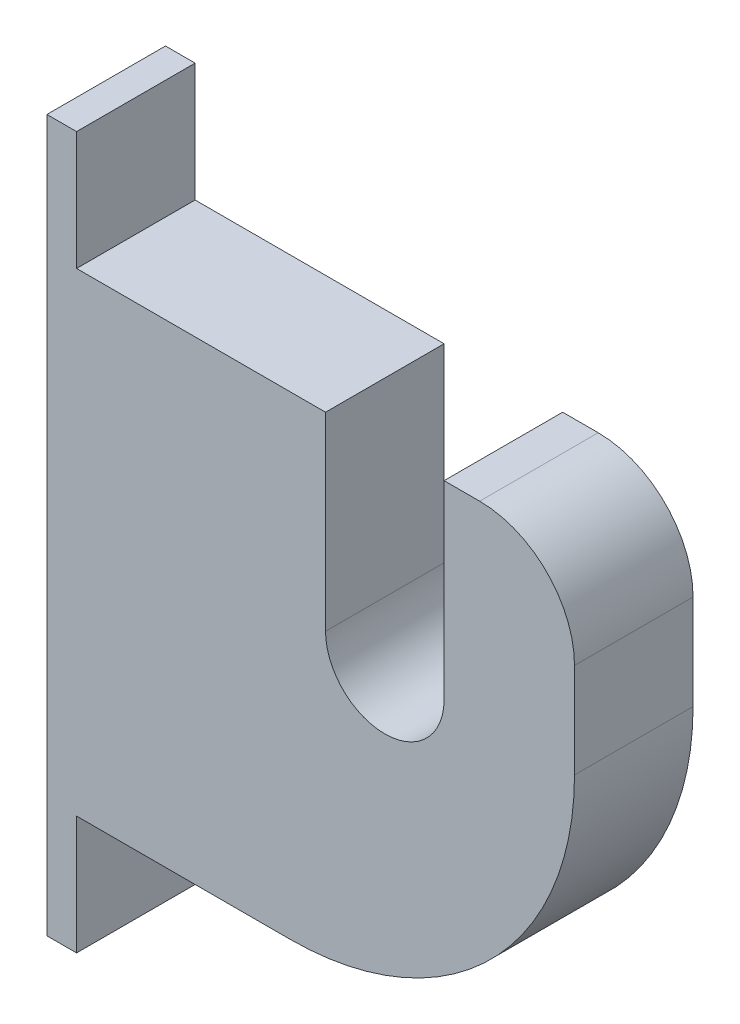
SolidWorks part; units mm, degrees
ref_plane "Front Plane" through (0, 0, 0) normal (0, 0, 1) x (1, 0, 0)
ref_plane "Top Plane" through (0, 0, 0) normal (0, 1, 0) x (1, 0, 0)
ref_plane "Right Plane" through (0, 0, 0) normal (1, 0, 0) x (0, 0, -1)
sketch "Sketch1" plane through (0, 0, 0) normal (0, 0, 1) x (1, 0, 0)
  line L0 (95.25, 1.27) -> (95.25, 3.81)
  line L1 (92.71, 6.35) -> (91.7575, 6.35)
  line L2 (88.5825, 6.35) -> (88.5825, 1.27)
  line L3 (88.5825, 6.35) -> (85.09, 6.35)
  line L4 (91.7575, 6.35) -> (91.7575, 1.27)
  line L5 (81.915, -6.35) -> (87.63, -6.35)
  line L6 (85.09, 6.35) -> (81.915, 6.35)
  line L9 (81.915, 6.35) -> (81.915, 9.525)
  line L10 (81.915, 9.525) -> (81.1213, 9.525)
  line L12 (81.1213, -6.35) -> (81.1213, 6.35)
  line L14 (81.1213, 6.35) -> (81.1213, 9.525)
  line L16 (81.1213, -6.35) -> (81.1213, -9.525)
  line L17 (81.1213, -9.525) -> (81.915, -9.525)
  line L18 (81.915, -6.35) -> (81.915, -9.525)
  arc A0 (88.5825, 1.27) -> (91.7575, 1.27) centre (90.17, 1.27) ccw
  arc A1 (87.63, -6.35) -> (95.25, 1.27) centre (87.63, 1.27) ccw
  arc A2 (92.71, 6.35) -> (95.25, 3.81) centre (92.71, 3.81) cw
  dimension "D1" = 2.54
  dimension "D2" = 3.4925
  dimension "D3" = 3.175
  dimension "D4" = 0.7937
extrude "Boss-Extrude1" add sketch "Sketch1" along normal blind 3.175
